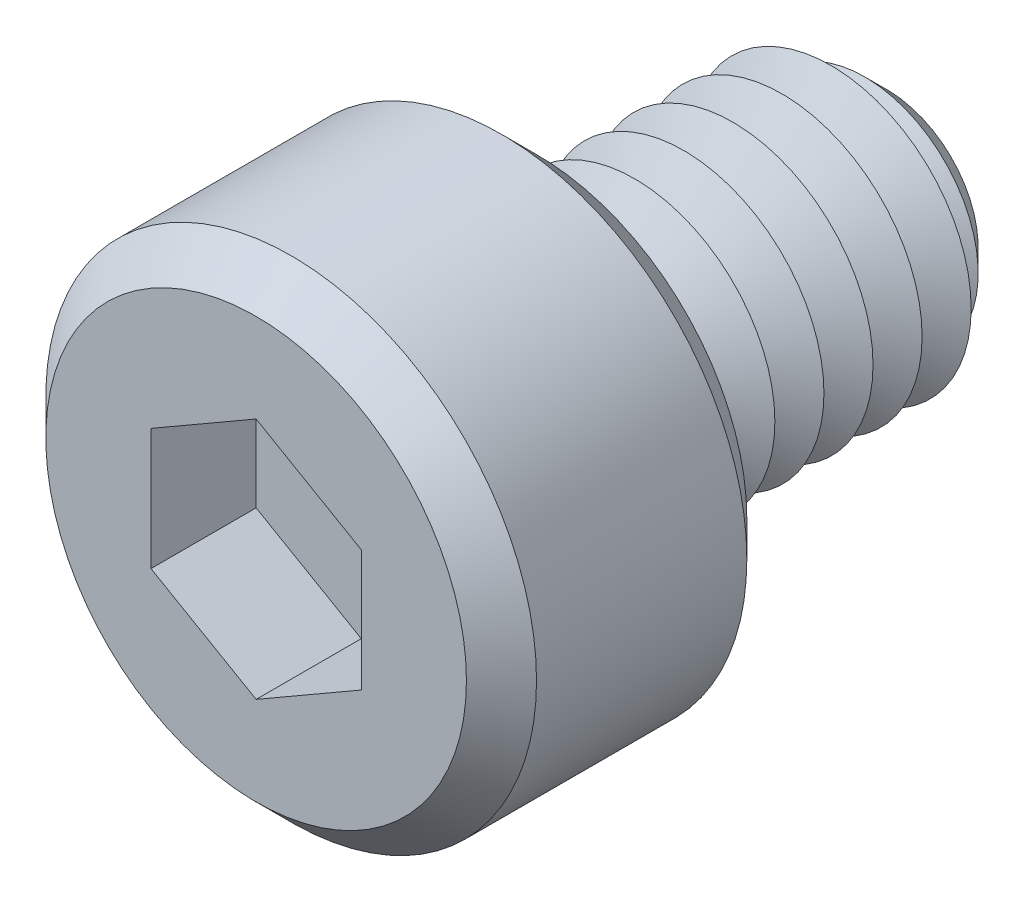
SolidWorks part; units mm, degrees
ref_plane "Front Plane" through (0, 0, 0) normal (0, 0, 1) x (1, 0, 0)
ref_plane "Top Plane" through (0, 0, 0) normal (0, 1, 0) x (1, 0, 0)
ref_plane "Right Plane" through (0, 0, 0) normal (1, 0, 0) x (0, 0, -1)
sketch "Sketch1" plane through (0, 0, 0) normal (0, 0, 1) x (1, 0, 0)
  circle A0 centre (0, 0) radius 3.5
  dimension "D1" = 7
extrude "Boss-Extrude1" add sketch "Sketch1" along normal blind 4
sketch "Sketch2" plane through (0, 0, 0) normal (0, 0, -1) x (-1, 0, 0)
  circle A0 centre (0, 0) radius 2
  dimension "D1" = 4
extrude "Boss-Extrude2" add sketch "Sketch2" along normal blind 5
chamfer "Chamfer1" distance 0.7 angle 45 1 edges at (-2, 0, -5)
sketch "Sketch3" plane through (0, 0, 0) normal (1, 0, 0) x (0, 0, -1)
  line L0 (-2.5121, 0) -> (4.5776, 0) construction
sketch "Sketch4" plane through (0, 0, 0) normal (1, 0, 0) x (0, 0, -1)
  line L0 (0, 2) -> (0.35, 1.3938)
  line L1 (0.35, 1.3938) -> (0.7, 2)
  line L2 (4.3, 2) -> (0, 2) construction
  line L3 (0.7, 2) -> (0, 2)
  dimension "D1" = 0.7
revolve "Cut-Revolve1" cut sketch "Sketch4" angle 360 about L0
pattern_linear "LPattern1" count 7 spacing 0.7 along (0, 0, -1) of "Cut-Revolve1"
sketch "Sketch5" plane through (0, 0, 4) normal (0, 0, 1) x (1, 0, 0)
  line L1 (0, 1.7321) -> (-1.5, 0.866)
  line L2 (-1.5, 0.866) -> (-1.5, -0.866)
  line L3 (-1.5, -0.866) -> (0, -1.7321)
  line L4 (0, -1.7321) -> (1.5, -0.866)
  line L5 (1.5, -0.866) -> (1.5, 0.866)
  line L6 (1.5, 0.866) -> (0, 1.7321)
  circle A0 centre (0, 0) radius 1.5 construction
  dimension "D1" = 3
extrude "Cut-Extrude1" cut sketch "Sketch5" against normal blind 1.5
sketch "Sketch6" plane through (0, 0, 2.5) normal (0, 0, 1) x (1, 0, 0)
  circle A0 centre (0, 0) radius 0.5
  dimension "D1" = 1
extrude "Cut-Extrude2" cut sketch "Sketch6" against normal up to surface (7.5 mm away)
chamfer "Chamfer2" distance 0.5 angle 45 2 edges at (3.5, 0, 0) (3.5, 0, 4)
